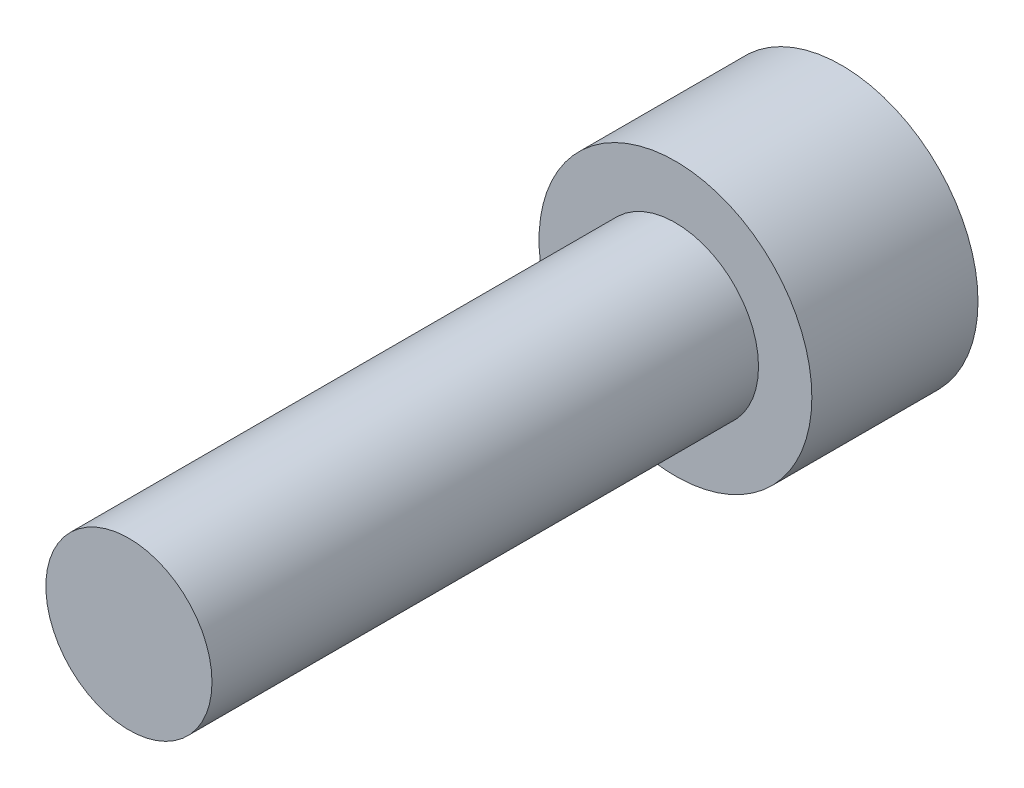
SolidWorks part; units mm, degrees
ref_plane "Front Plane" through (0, 0, 0) normal (0, 0, 1) x (1, 0, 0)
ref_plane "Top Plane" through (0, 0, 0) normal (0, 1, 0) x (1, 0, 0)
ref_plane "Right Plane" through (0, 0, 0) normal (1, 0, 0) x (0, 0, -1)
sketch "Sketch6" plane through (0, 0, 0) normal (1, 0, 0) x (0, 0, -1)
  line L0 (-15.875, 0) -> (22.525, 0) construction
  line L1 (4.3586, 0) -> (-4.3586, 0) construction
  line L2 (-15.875, 0) -> (-15.875, -2.413)
  line L3 (-15.875, -2.413) -> (0, -2.413)
  line L4 (0, 4.3586) -> (0, -4.3586) construction
  line L5 (0, -2.413) -> (0, -3.9624)
  line L6 (0, -3.9624) -> (4.826, -3.9624)
  line L7 (4.826, -3.9624) -> (4.826, 0)
  line L8 (4.826, 0) -> (-15.875, 0)
  dimension "L" = 15.875
  dimension "H" = 4.826
  dimension "A" = 7.9248
  dimension "D" = 4.826
revolve "Revolve1" add sketch "Sketch6" angle 360 about L0
sketch "Sketch7" plane through (0, 0, -4.826) normal (0, 0, -1) x (-1, 0, 0)
  line L2 (-1.9812, 1.1438) -> (-1.9812, -1.1438)
  line L4 (-1.9812, -1.1438) -> (0, -2.2877)
  line L5 (0, -2.2877) -> (1.9812, -1.1438)
  line L6 (1.9812, -1.1438) -> (1.9812, 1.1438)
  line L7 (1.9812, 1.1438) -> (0, 2.2877)
  line L8 (0, 2.2877) -> (-1.9812, 1.1438)
  circle A0 centre (0, 0) radius 1.9812 construction
  dimension "J" = 3.9624
extrude "HEX" cut sketch "Sketch7" against normal blind 3.048
